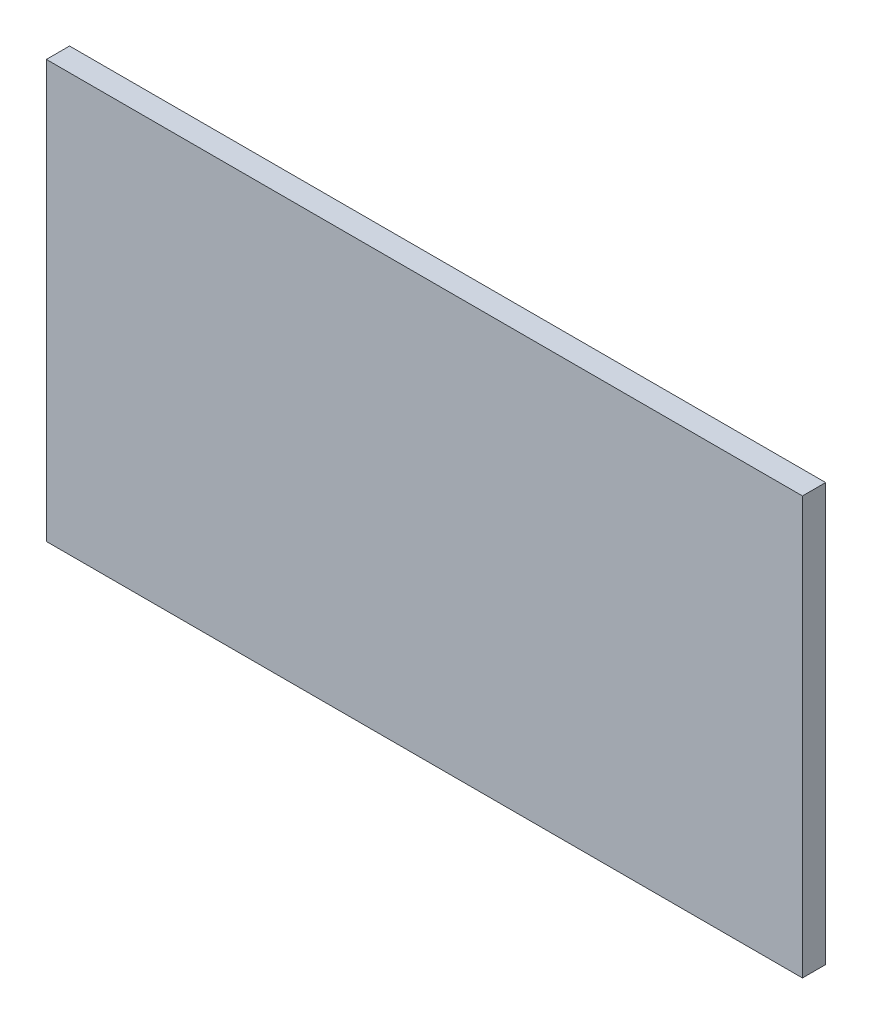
SolidWorks part; units mm, degrees
ref_plane "Plan de face" through (0, 0, 0) normal (0, 0, 1) x (1, 0, 0)
ref_plane "Plan de dessus" through (0, 0, 0) normal (0, 1, 0) x (1, 0, 0)
ref_plane "Plan de droite" through (0, 0, 0) normal (1, 0, 0) x (0, 0, -1)
sketch "Esquisse1" plane through (0, 0, 0) normal (0, 0, 1) x (1, 0, 0)
  line L1 (0, 0) -> (-3260, 0)
  line L2 (0, 0) -> (0, 1800)
  line L3 (0, 1800) -> (-3260, 1800)
  line L4 (-3260, 0) -> (-3260, 1800)
  dimension "D1" = 1800
  dimension "D2" = 3260
extrude "Boss.-Extru.1" add sketch "Esquisse1" against normal blind 100
